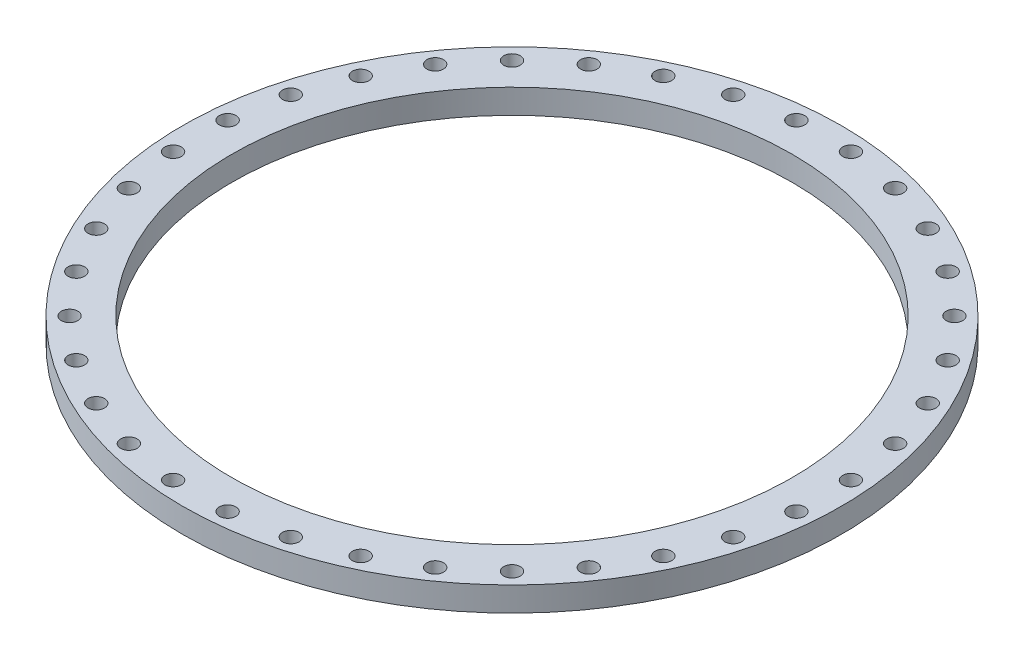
SolidWorks part; units mm, degrees
ref_plane "Face" through (0, 0, 0) normal (0, 0, 1) x (1, 0, 0)
ref_plane "Dessus" through (0, 0, 0) normal (0, 1, 0) x (1, 0, 0)
ref_plane "Droite" through (0, 0, 0) normal (1, 0, 0) x (0, 0, -1)
sketch "Esquisse1" plane through (0, 0, 0) normal (0, 0, 1) x (1, 0, 0)
  line L0 (0, 0) -> (0, 62) construction
  line L1 (-837.5, 62) -> (-712, 62)
  line L2 (-837.5, 62) -> (-837.5, 0)
  line L3 (-837.5, 0) -> (-712, 0)
  line L4 (-712, 62) -> (-712, 0)
  line L5 (-711, 62) -> (-711, 0) construction
  line L6 (-711, 0) -> (0, 0) construction
  line L7 (0, 0) -> (711, 0) construction
  line L8 (711, 0) -> (711, 62) construction
  line L9 (711, 62) -> (-711, 62) construction
  dimension "Di" = 1424
  dimension "E" = 62
  dimension "De" = 1675
  dimension "Dn" = 1422
revolve "Révolution1" add sketch "Esquisse1" angle 360 about L0
hole_wizard "Diamètre du perçage Ø18.0 (18)1" positions "Esquisse3" profile "Esquisse2" hole size "Ø18.0" standard "ISO"
sketch "Esquisse3" plane through (0, 62, 0) normal (0, 1, 0) x (1, 0, 0)
  line L0 (0, 0) -> (69.2888, 791.9748) construction
  line L1 (0, 0) -> (0, 795) construction
  line L3 (-795, 0) -> (795, 0) construction
  line L5 (0, 0) -> (0, -795) construction
  circle A0 centre (0, 0) radius 795 construction
  point P0 (69.2888, 791.9748)
  dimension "K" = 1590
  dimension "Ang_Tr" = 5
sketch "Esquisse2" plane through (69.2888, 62, -791.9748) normal (1, 0, 0) x (0, 0, 1)
  line L0 (0, 0) -> (0, 62)
  line L1 (0, 62) -> (21, 62)
  line L2 (21, 62) -> (21, 0)
  line L5 (21, 0) -> (0, 0)
  line L11 (0, -6.35) -> (0, 107.95) construction
  dimension "L" = 42
  dimension "Profondeur du perçage jusqu'au prochain" = 62
pattern_circular "Répétition circulaire1" count 36 over 360 about axis through (0, 0, 0) along (0, 1, 0) of "Diamètre du perçage Ø18.0 (18)1"
